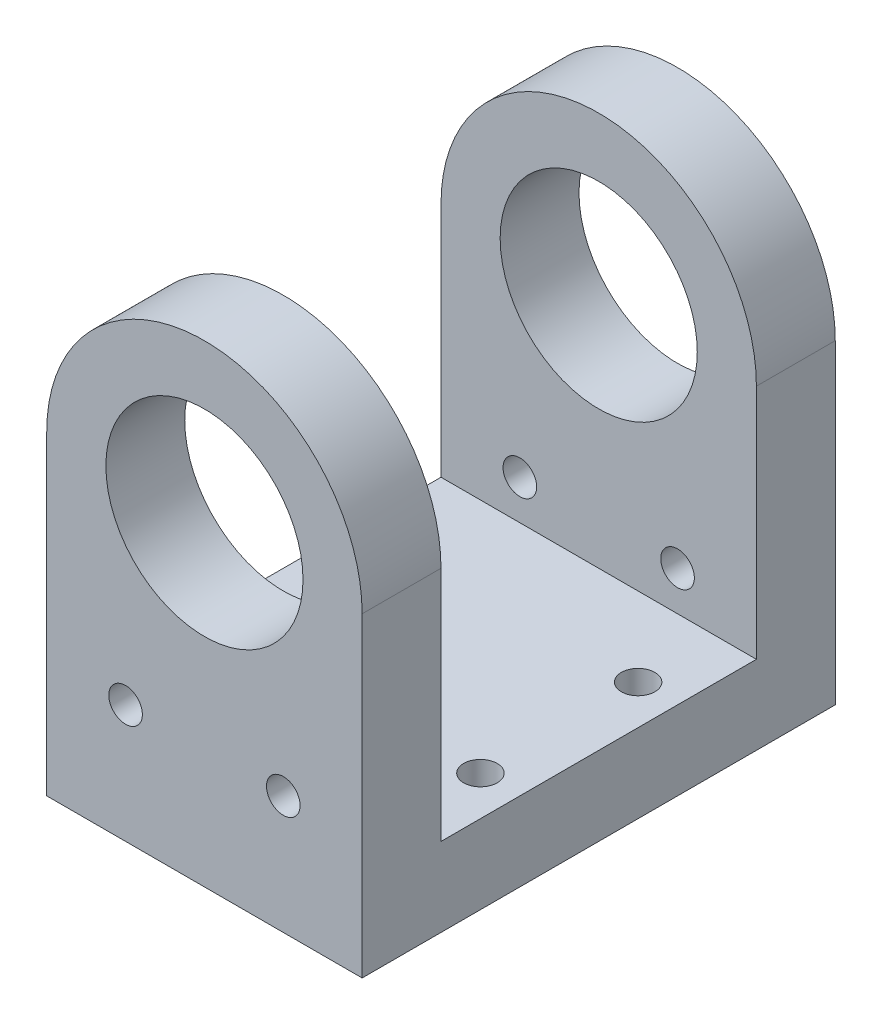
SolidWorks part; units mm, degrees
ref_plane "SAGITTAL" through (0, 0, 0) normal (0, 0, 1) x (1, 0, 0)
ref_plane "Top" through (0, 0, 0) normal (0, 1, 0) x (1, 0, 0)
ref_plane "Right" through (0, 0, 0) normal (1, 0, 0) x (0, 0, -1)
sketch "Sketch1" plane through (0, 0, 0) normal (0, 0, 1) x (1, 0, 0)
  line L0 (12.7, 0) -> (-12.7, 0)
  line L1 (-12.7, 0) -> (-12.7, 25.4)
  line L5 (0, 0) -> (0, 25.4) construction
  line L8 (12.7, 0) -> (12.7, 25.4)
  circle A0 centre (0, 25.4) radius 7.9375
  arc A1 (12.7, 25.4) -> (-12.7, 25.4) centre (0, 25.4) ccw
  dimension "D5" = 15.875
  dimension "D1" = 25.4
  dimension "D2" = 25.4
extrude "Extrude1" add sketch "Sketch1" along normal mid plane 38.1
sketch "Sketch2" plane through (12.7, 0, 0) normal (1, 0, 0) x (0, 0, -1)
  line L0 (0, 0) -> (0, 21.5049) construction
  line L1 (-12.7, 6.35) -> (12.7, 6.35)
  line L2 (-12.7, 6.35) -> (-12.7, 41.0459)
  line L3 (-12.7, 41.0459) -> (12.7, 41.0459)
  line L4 (12.7, 6.35) -> (12.7, 41.0459)
  dimension "D1" = 6.35
  dimension "D2" = 25.4
extrude "Cut-Extrude1" cut sketch "Sketch2" against normal through all
hole_wizard "#6-32 Tapped Hole1" positions "Sketch4" profile "Sketch3" tap size "#6-32" standard "Ansi Inch"
sketch "Sketch4" plane through (0, 0, 0) normal (0, -1, 0) x (1, 0, 0)
  line L0 (0, 0) -> (-10.7337, 0) construction
  line L1 (-10.7337, 0) -> (0, 11.1943) construction
  line L2 (0, 11.1943) -> (0, 0) construction
  point P0 (-9.525, -6.35)
  point P12 (-9.525, 6.35)
  point P14 (9.525, -6.35)
  point P15 (9.525, 6.35)
  dimension "D1" = 19.05
  dimension "D2" = 12.7
sketch "Sketch3" plane through (-9.525, 0, -6.35) normal (1, 0, 0) x (0, 0, -1)
  line L0 (0, 0) -> (0, 38.1)
  line L1 (0, 38.1) -> (1.3525, 38.1)
  line L2 (1.3525, 38.1) -> (1.3525, 0)
  line L5 (1.3525, 0) -> (0, 0)
  line L11 (0, -6.35) -> (0, 107.95) construction
  dimension "Thru Tap Drill Dia." = 2.7051
  dimension "Thru Tap Drill Depth" = 38.1
hole_wizard "#6-32 Tapped Hole2" positions "Sketch6" profile "Sketch5" tap size "#6-32" standard "Ansi Inch"
sketch "Sketch6" plane through (0, 0, -19.05) normal (0, 0, -1) x (-1, 0, 0)
  line L0 (0, 0) -> (0, 25.4) construction
  line L2 (12.7, 0) -> (-12.7, 0) construction
  point P0 (6.35, 9.525)
  point P8 (-6.35, 9.525)
  dimension "D1" = 12.7
  dimension "D2" = 9.525
sketch "Sketch5" plane through (-6.35, 9.525, -19.05) normal (1, 0, 0) x (0, 1, 0)
  line L0 (0, 0) -> (0, 38.1)
  line L1 (0, 38.1) -> (1.3525, 38.1)
  line L2 (1.3525, 38.1) -> (1.3525, 0)
  line L5 (1.3525, 0) -> (0, 0)
  line L11 (0, -6.35) -> (0, 107.95) construction
  dimension "Thru Tap Drill Dia." = 2.7051
  dimension "Thru Tap Drill Depth" = 38.1
sketch "Sketch7" plane through (0, 0, -19.05) normal (0, 0, -1) x (-1, 0, 0)
  line L1 (11.6761, 22.7884) -> (15.8259, 22.7884)
  line L2 (11.6761, 22.7884) -> (11.6761, 8.1713)
  line L3 (11.6761, 8.1713) -> (15.8259, 8.1713)
  line L4 (15.8259, 22.7884) -> (15.8259, 8.1713)
